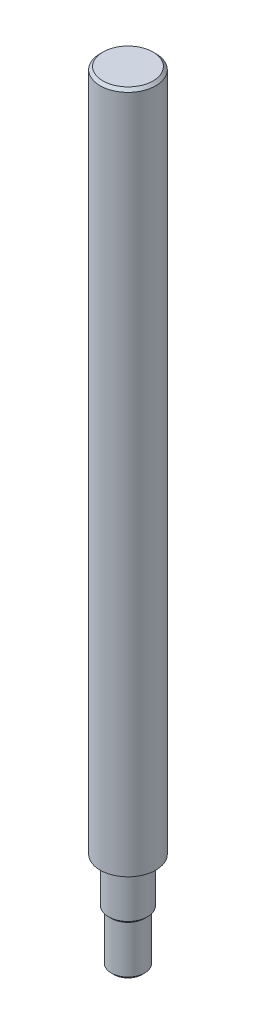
SolidWorks part; units mm, degrees
ref_plane "前视基准面" through (0, 0, 0) normal (0, 0, 1) x (1, 0, 0)
ref_plane "上视基准面" through (0, 0, 0) normal (0, 1, 0) x (1, 0, 0)
ref_plane "右视基准面" through (0, 0, 0) normal (1, 0, 0) x (0, 0, -1)
sketch "草图1" plane through (0, 0, 0) normal (0, 1, 0) x (1, 0, 0)
  circle A0 centre (0, 0) radius 10
extrude "凸台-拉伸1" add sketch "草图1" along normal blind 245
sketch "草图2" plane through (0, 0, 0) normal (0, -1, 0) x (1, 0, 0)
  circle A0 centre (0, 0) radius 7
extrude "凸台-拉伸2" add sketch "草图2" along normal blind 17
sketch "草图3" plane through (0, -17, 0) normal (0, -1, 0) x (1, 0, 0)
  circle A0 centre (0, 0) radius 6
extrude "凸台-拉伸3" add sketch "草图3" along normal blind 18 separate body
chamfer "倒角1" distance 1 angle 45 1 edges at (0, -35, -6)
chamfer "倒角2" distance 1 angle 45 1 edges at (0, -17, -7)
chamfer "倒角3" distance 1 angle 45 1 edges at (0, 245, 10)
